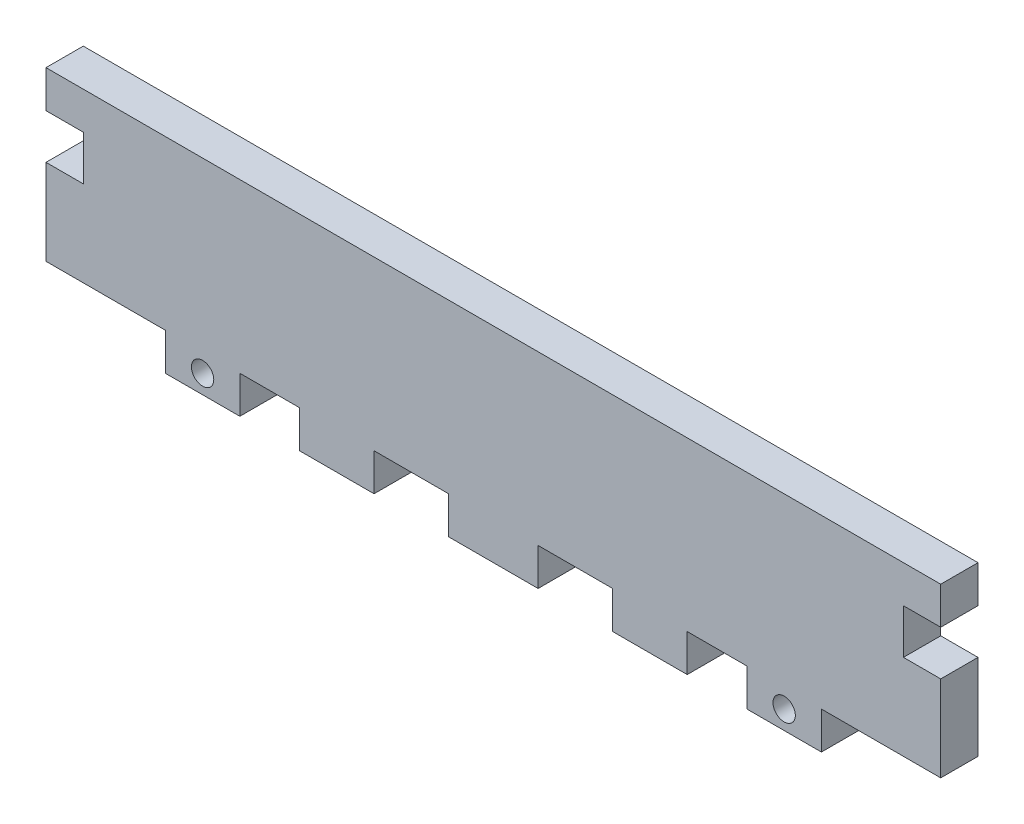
SolidWorks part; units mm, degrees
ref_plane "Front Plane" through (0, 0, 0) normal (0, 0, 1) x (1, 0, 0)
ref_plane "Top Plane" through (0, 0, 0) normal (0, 1, 0) x (1, 0, 0)
ref_plane "Right Plane" through (0, 0, 0) normal (1, 0, 0) x (0, 0, -1)
sketch "Sketch1" plane through (0, 0, 0) normal (0, 0, 1) x (1, 0, 0)
  line L0 (-76.2, 28.575) -> (-76.2, 0) construction
  line L1 (-152.4, 28.575) -> (0, 28.575)
  line L2 (-152.4, 28.575) -> (-152.4, 0)
  line L3 (-152.4, 0) -> (0, 0)
  line L4 (0, 28.575) -> (0, 0)
  line L14 (-152.4, 22.225) -> (-146.05, 22.225)
  line L15 (-152.4, 22.225) -> (-152.4, 14.605)
  line L16 (-152.4, 14.605) -> (-146.05, 14.605)
  line L17 (-146.05, 22.225) -> (-146.05, 14.605)
  line L18 (0, 22.225) -> (-6.35, 22.225)
  line L19 (0, 22.225) -> (0, 14.605)
  line L20 (0, 14.605) -> (-6.35, 14.605)
  line L21 (-6.35, 22.225) -> (-6.35, 14.605)
  point P4 (0, 0)
  dimension "D1" = 152.4
  dimension "D2" = 28.575
  dimension "D3" = 14.605
  dimension "D4" = 14.605
  dimension "D9" = 6.35
  dimension "D10" = 6.35
  dimension "D11" = 7.62
  dimension "D12" = 7.62
extrude "Boss-Extrude1" add sketch "Sketch1" along normal blind 6.35
sketch "Sketch2" plane through (0, 0, 0) normal (0, -1, 0) x (1, 0, 0)
  line L0 (-152.4, 6.35) -> (0, 6.35) construction
  line L5 (-152.4, 0) -> (0, 0) construction
  line L19 (-152.4, 6.35) -> (-152.4, 0) construction
  line L20 (-76.2, 6.35) -> (-76.2, 0) construction
  line L21 (0, 6.35) -> (0, 0) construction
  line L22 (-83.82, 0) -> (-68.58, 0)
  line L23 (-83.82, 0) -> (-83.82, 6.35)
  line L24 (-83.82, 6.35) -> (-68.58, 6.35)
  line L25 (-68.58, 0) -> (-68.58, 6.35)
  line L26 (-83.82, 0) -> (-68.58, 6.35) construction
  line L27 (-83.82, 6.35) -> (-68.58, 0) construction
  line L28 (-132.08, 6.35) -> (-119.38, 6.35)
  line L29 (-132.08, 6.35) -> (-132.08, 0)
  line L30 (-132.08, 0) -> (-119.38, 0)
  line L31 (-119.38, 6.35) -> (-119.38, 0)
  line L32 (-109.22, 6.35) -> (-96.52, 6.35)
  line L33 (-109.22, 6.35) -> (-109.22, 0)
  line L34 (-109.22, 0) -> (-96.52, 0)
  line L35 (-96.52, 6.35) -> (-96.52, 0)
  line L36 (-20.32, 6.35) -> (-33.02, 6.35)
  line L37 (-20.32, 6.35) -> (-20.32, 0)
  line L38 (-20.32, 0) -> (-33.02, 0)
  line L39 (-33.02, 6.35) -> (-33.02, 0)
  line L40 (-55.88, 6.35) -> (-43.18, 6.35)
  line L41 (-55.88, 6.35) -> (-55.88, 0)
  line L42 (-55.88, 0) -> (-43.18, 0)
  line L43 (-43.18, 6.35) -> (-43.18, 0)
  point P10 (-76.2, 3.175)
  dimension "D1" = 20.32
  dimension "D2" = 15.24
  dimension "D3" = 12.7
  dimension "D4" = 10.16
  dimension "D5" = 12.7
  dimension "D6" = 20.32
  dimension "D7" = 12.7
  dimension "D8" = 10.16
  dimension "D9" = 12.7
extrude "Boss-Extrude2" add sketch "Sketch2" along normal blind 6.35
sketch "Sketch3" plane through (0, 0, 6.35) normal (0, 0, 1) x (1, 0, 0)
  line L0 (-132.08, -3.175) -> (-119.38, -3.175) construction
  line L1 (-132.08, -6.35) -> (-132.08, 0) construction
  line L2 (-119.38, -6.35) -> (-119.38, 0) construction
  line L3 (-33.02, -3.175) -> (-20.32, -3.175) construction
  line L4 (-33.02, -6.35) -> (-33.02, 0) construction
  line L5 (-20.32, -6.35) -> (-20.32, 0) construction
  circle A0 centre (-125.73, -3.175) radius 1.905
  circle A1 centre (-26.67, -3.175) radius 1.905
  dimension "D1" = 3.81
  dimension "D2" = 3.81
extrude "Cut-Extrude1" cut sketch "Sketch3" against normal blind 19.05
